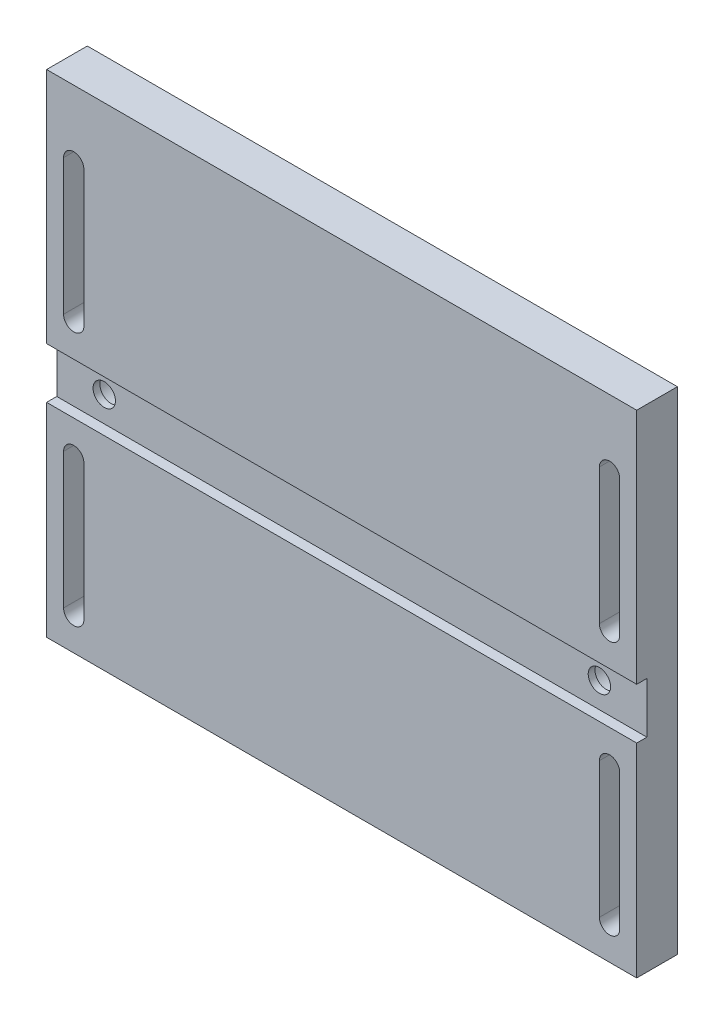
SolidWorks part; units mm, degrees
ref_plane "Face" through (0, 0, 0) normal (0, 0, 1) x (1, 0, 0)
ref_plane "Dessus" through (0, 0, 0) normal (0, 1, 0) x (1, 0, 0)
ref_plane "Droite" through (0, 0, 0) normal (1, 0, 0) x (0, 0, -1)
sketch "Esquisse1" plane through (0, 0, 0) normal (0, 0, 1) x (1, 0, 0)
  line L1 (-87, 72.5) -> (87, 72.5)
  line L2 (-87, 72.5) -> (-87, -72.5)
  line L3 (-87, -72.5) -> (87, -72.5)
  line L4 (87, 72.5) -> (87, -72.5)
  dimension "D1" = 174
  dimension "D2" = 145
  dimension "D3" = 87
  dimension "D4" = 72.5
extrude "Extrusion1" add sketch "Esquisse1" along normal blind 12
sketch "Esquisse2" plane through (0, 0, 12) normal (0, 0, 1) x (1, 0, 0)
  line L0 (-87, 72.5) -> (-87, -72.5) construction
  line L1 (-87, 2.5) -> (87, 2.5)
  line L2 (-87, 2.5) -> (-87, -12.5)
  line L3 (-87, -12.5) -> (87, -12.5)
  line L4 (87, 2.5) -> (87, -12.5)
  line L5 (87, -72.5) -> (87, 72.5) construction
  line L6 (-87, -72.5) -> (87, -72.5) construction
  dimension "D1" = 15
  dimension "D2" = 60
extrude "Enlèv. mat.-Extru.1" cut sketch "Esquisse2" against normal blind 3
hole_wizard "Chambrage pour vis à tête cylindrique fendue M61" positions "Esquisse4" profile "Esquisse3" counterbore size "M6" standard "ISO"
sketch "Esquisse4" plane through (0, 0, 0) normal (0, 0, -1) x (-1, 0, 0)
  line L0 (92.9243, -5) -> (-97.143, -5) construction
  line L1 (-87, 2.5) -> (87, 2.5) construction
  line L2 (87, 72.5) -> (87, -72.5) construction
  line L3 (-87, -72.5) -> (-87, 72.5) construction
  point P0 (-73, -5)
  point P1 (73, -5)
  dimension "D1" = 7.5
  dimension "D2" = 14
  dimension "D3" = 14
sketch "Esquisse3" plane through (73, -5, 0) normal (1, 0, 0) x (0, 1, 0)
  line L0 (0, 0) -> (0, 13.9828)
  line L1 (0, 13.9828) -> (3.3, 12)
  line L2 (3.3, 12) -> (3.3, 7)
  line L3 (3.3, 7) -> (5.5, 7)
  line L4 (5.5, 7) -> (5.5, 0)
  line L5 (5.5, 0) -> (0, 0)
  line L10 (0, 13.9828) -> (-3.3, 12) construction
  line L11 (0, -6.35) -> (0, 107.95) construction
  dimension "Diamètre du perçage" = 6.6
  dimension "Profondeur du perçage" = 12
  dimension "Diamètre du chambrage" = 11
  dimension "Profondeur du chambrage" = 7
  dimension "Angle de pointe" = 118
sketch "Esquisse5" plane through (0, 0, 0) normal (0, 0, -1) x (-1, 0, 0)
  line L0 (79, 77.2704) -> (79, -7.5494) construction
  line L1 (76, 52.5) -> (76, 12.5)
  line L2 (-87, 72.5) -> (87, 72.5) construction
  line L3 (0, 110.7748) -> (0, -125.861) construction
  line L4 (73, -5) -> (-73, -5) construction
  line L5 (-82, 52.5) -> (-82, 12.5)
  line L6 (82, 52.5) -> (82, 12.5)
  line L7 (87, 72.5) -> (87, -72.5) construction
  line L8 (-76, 52.5) -> (-76, 12.5)
  line L9 (-76, -62.5) -> (-76, -22.5)
  line L10 (-82, -62.5) -> (-82, -22.5)
  line L11 (82, -62.5) -> (82, -22.5)
  line L12 (76, -62.5) -> (76, -22.5)
  arc A0 (82, 52.5) -> (76, 52.5) centre (79, 52.5) ccw
  arc A1 (76, 12.5) -> (82, 12.5) centre (79, 12.5) ccw
  arc A2 (-76, 12.5) -> (-82, 12.5) centre (-79, 12.5) cw
  arc A3 (-82, 52.5) -> (-76, 52.5) centre (-79, 52.5) cw
  arc A4 (-82, -62.5) -> (-76, -62.5) centre (-79, -62.5) ccw
  arc A5 (-76, -22.5) -> (-82, -22.5) centre (-79, -22.5) ccw
  arc A6 (76, -22.5) -> (82, -22.5) centre (79, -22.5) cw
  arc A7 (82, -62.5) -> (76, -62.5) centre (79, -62.5) cw
  dimension "D2" = 40
  dimension "D1" = 6
  dimension "D3" = 8
  dimension "D4" = 20
extrude "Enlèv. mat.-Extru.2" cut sketch "Esquisse5" against normal through all
hole_wizard "Trou taraudé M6x1.01" positions "Esquisse10" profile "Esquisse9" tap size "M6x1.0" standard "ISO"
sketch "Esquisse10" plane through (0, -72.5, 0) normal (0, -1, 0) x (1, 0, 0)
  line L0 (64, 6) -> (-43.5495, 6) construction
  line L1 (87, 12) -> (87, 0) construction
  line L2 (-87, 12) -> (87, 12) construction
  line L3 (-87, 0) -> (87, 0) construction
  point P0 (-17.5, 6)
  point P1 (17.5, 6)
  dimension "D1" = 69.5
  dimension "D2" = 35
sketch "Esquisse9" plane through (-17.5, -72.5, 6) normal (1, 0, 0) x (0, 0, -1)
  line L0 (0, 0) -> (0, 31.4421)
  line L1 (0, 31.4421) -> (2.4, 30)
  line L2 (2.4, 30) -> (2.4, 0)
  line L5 (2.4, 0) -> (0, 0)
  line L10 (0, 31.4421) -> (-2.4, 30) construction
  line L11 (0, -6.35) -> (0, 107.95) construction
  dimension "Diamètre du trou pour taraudage" = 4.8
  dimension "Profondeur du trou pour taraudage" = 30
  dimension "Angle de pointe" = 118
